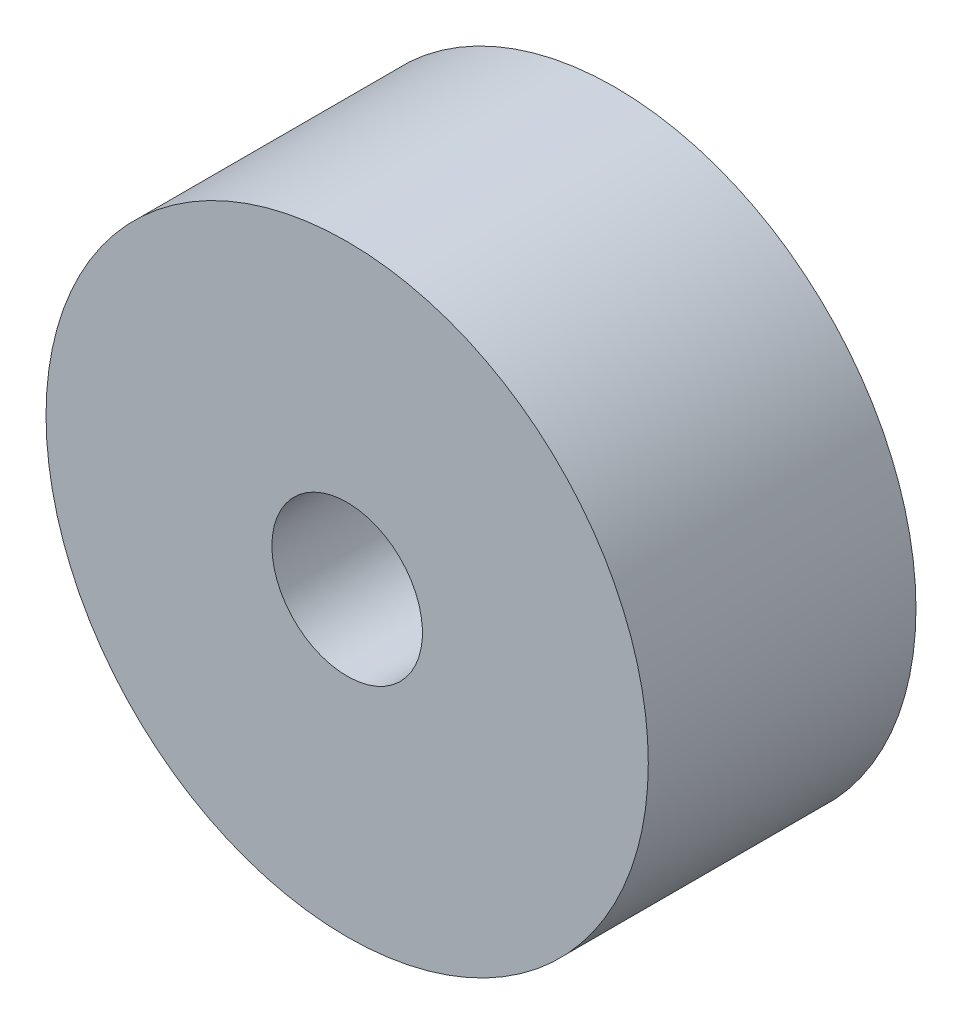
SolidWorks part; units mm, degrees
ref_plane "Plan de face" through (0, 0, 0) normal (0, 0, 1) x (1, 0, 0)
ref_plane "Plan de dessus" through (0, 0, 0) normal (0, 1, 0) x (1, 0, 0)
ref_plane "Plan de droite" through (0, 0, 0) normal (1, 0, 0) x (0, 0, -1)
sketch "Esquisse1" plane through (0, 0, 0) normal (0, 0, 1) x (1, 0, 0)
  circle A0 centre (0, 0) radius 9
  dimension "D1" = 18
extrude "Extrusion1" add sketch "Esquisse1" along normal blind 8
sketch "Esquisse2" plane through (0, 0, 0) normal (0, 0, -1) x (-1, 0, 0)
  circle A0 centre (0, 0) radius 2.25
  dimension "D1" = 4.5
extrude "Enlèv. mat.-Extru.1" cut sketch "Esquisse2" against normal through all
chamfer "Chanfrein1" distance 2.5 angle 45 1 edges at (-2.25, 0, 0)
